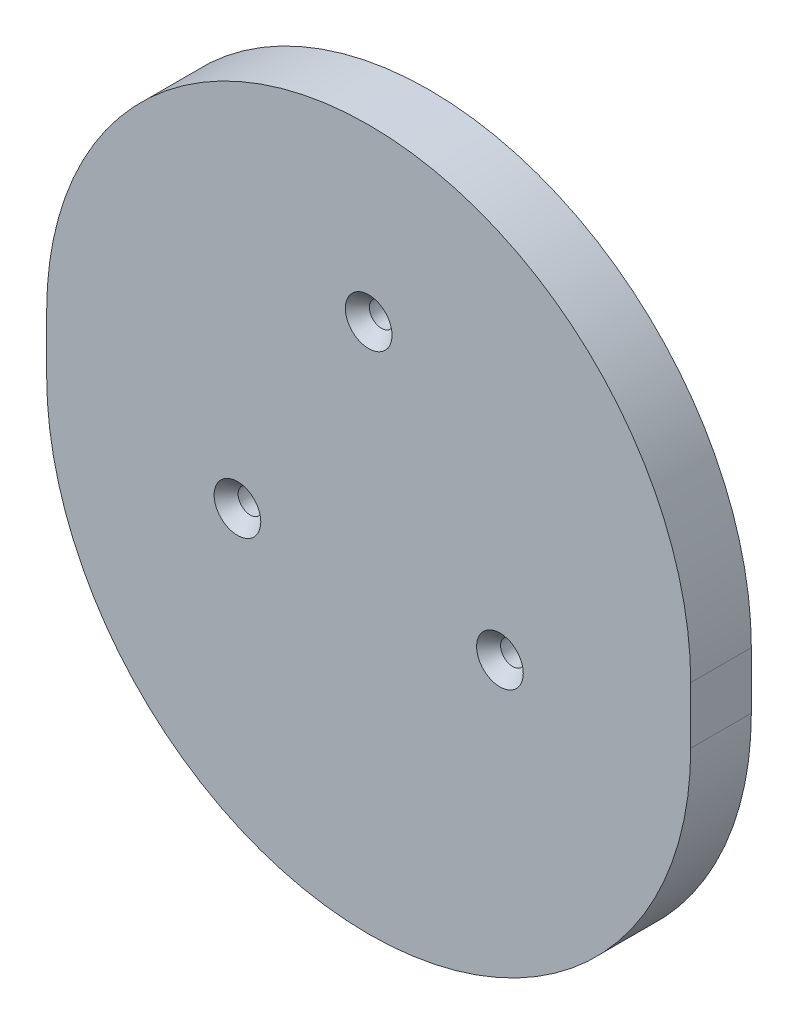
SolidWorks part; units mm, degrees
ref_plane "Front Plane" through (0, 0, 0) normal (0, 0, 1) x (1, 0, 0)
ref_plane "Top Plane" through (0, 0, 0) normal (0, 1, 0) x (1, 0, 0)
ref_plane "Right Plane" through (0, 0, 0) normal (1, 0, 0) x (0, 0, -1)
sketch "Sketch2" plane through (0, 0, 0) normal (0, 0, 1) x (1, 0, 0)
  line L0 (0, 0) -> (0, 82.931) construction
  line L2 (-82.423, 34.1376) -> (-99.0577, 34.1376)
  line L4 (91.948, -48.7934) -> (91.948, 34.1376) construction
  line L5 (99.0577, 34.1376) -> (82.423, 34.1376)
  line L6 (-91.948, -48.7934) -> (-91.948, 34.1376) construction
  line L7 (82.423, -14.3002) -> (82.423, -48.4124)
  line L9 (82.423, 34.1376) -> (82.423, 14.2748)
  line L10 (82.423, -48.4124) -> (92.9195, -48.4124)
  line L11 (-82.423, -48.4124) -> (-92.9195, -48.4124)
  line L12 (-82.423, 34.1376) -> (-82.423, -48.4124)
  arc A0 (99.0577, 34.1376) -> (-99.0577, 34.1376) centre (0, 0) ccw
  arc A1 (82.423, 14.2748) -> (82.423, -14.3002) centre (82.423, -0.0127) ccw
  arc A2 (-92.9195, -48.4124) -> (92.9195, -48.4124) centre (0, 0) ccw
  circle A3 centre (0, 0) radius 132.5563 construction
  dimension "D4" = 209.55
  dimension "D7" = 28.575
  dimension "D14" = 265.1125
  dimension "D2" = 164.846
  dimension "D3" = 19.8628
  dimension "D5" = 34.1376
  dimension "D6" = 183.896
  dimension "D8" = 48.4124
  dimension "D9" = 82.423
  dimension "D10" = 82.423
  dimension "D11" = 91.948
  dimension "D12" = 91.948
  dimension "D13" = 82.55
extrude "Boss-Extrude1" add sketch "Sketch2" against normal blind 12.7
hole_wizard "#10-32 Tapped Hole1" positions "Sketch11" profile "Sketch10" tap size "#10-32" standard "Ansi Inch"
sketch "Sketch11" plane through (82.423, 0, 0) normal (1, 0, 0) x (0, 0, -1)
  line L0 (12.7, 34.1376) -> (0, 34.1376) construction
  line L2 (12.7, 34.1376) -> (12.7, -48.4124) construction
  line L3 (12.7, -48.4124) -> (0, -48.4124) construction
  point P0 (6.35, 24.6126)
  point P4 (6.35, -38.8874)
  dimension "D1" = 6.35
  dimension "D2" = 9.525
  dimension "D3" = 24.6126
  dimension "D4" = 63.5
  dimension "D5" = 38.8874
  dimension "D6" = 9.525
sketch "Sketch10" plane through (82.423, 24.6126, -6.35) normal (0, 1, 0) x (0, 0, -1)
  line L0 (0, 0) -> (0, 13.2529)
  line L1 (0, 13.2529) -> (2.0193, 12.0396)
  line L2 (2.0193, 12.0396) -> (2.0193, 0)
  line L5 (2.0193, 0) -> (0, 0)
  line L10 (0, 13.2529) -> (-2.0193, 12.0396) construction
  line L11 (0, -6.35) -> (0, 107.95) construction
  dimension "Tap Drill Dia." = 4.0386
  dimension "Tap Drill Depth" = 12.0396
  dimension "Drill Angle" = 118
hole_wizard "#10-32 Tapped Hole2" positions "Sketch13" profile "Sketch12" tap size "#10-32" standard "Ansi Inch"
sketch "Sketch13" plane through (-82.423, 0, 0) normal (-1, 0, 0) x (0, 0, 1)
  line L1 (-12.7, 34.1376) -> (0, 34.1376) construction
  line L3 (-12.7, 34.1376) -> (-12.7, -48.4124) construction
  point P0 (-6.35, -38.8874)
  point P4 (-6.35, 24.6126)
  dimension "D1" = 6.35
  dimension "D2" = 63.5
  dimension "D3" = 9.525
  dimension "D4" = 24.6126
  dimension "D5" = 38.8874
sketch "Sketch12" plane through (-82.423, -38.8874, -6.35) normal (0, 1, 0) x (0, 0, 1)
  line L0 (0, 0) -> (0, 13.2529)
  line L1 (0, 13.2529) -> (2.0193, 12.0396)
  line L2 (2.0193, 12.0396) -> (2.0193, 0)
  line L5 (2.0193, 0) -> (0, 0)
  line L10 (0, 13.2529) -> (-2.0193, 12.0396) construction
  line L11 (0, -6.35) -> (0, 107.95) construction
  dimension "Tap Drill Dia." = 4.0386
  dimension "Tap Drill Depth" = 12.0396
  dimension "Drill Angle" = 118
hole_wizard "CSK for #10 Flat Head Machine Screw1" positions "Sketch9" profile "Sketch8" countersink size "#10" standard "ANSI Inch"
sketch "Sketch9" plane through (82.423, 26.8097, 0) normal (0, 0, 1) x (1, 0, 0)
  line L3 (-82.423, -26.8097) -> (-82.423, 4.9403) construction
  line L4 (-82.423, -26.8097) -> (-54.9267, -42.6847) construction
  line L5 (-82.423, -26.8097) -> (-109.9193, -42.6847) construction
  circle A1 centre (-82.423, -26.8097) radius 31.75 construction
  point P9 (-82.423, 4.9403)
  point P11 (-54.9267, -42.6847)
  point P46 (-109.9193, -42.6847)
  dimension "D1" = 31.75
  dimension "D3" = 120
  dimension "D2" = 120
sketch "Sketch8" plane through (0, 31.75, 0) normal (1, 0, 0) x (0, -1, 0)
  line L0 (0, 0) -> (0, 12.7)
  line L1 (0, 12.7) -> (2.5527, 12.7)
  line L2 (2.5527, 12.7) -> (2.5527, 2.6882)
  line L3 (2.5527, 2.6882) -> (4.8895, 0)
  line L5 (4.8895, 0) -> (0, 0)
  line L6 (-2.5527, 2.6882) -> (-4.8895, 0) construction
  line L11 (0, -6.35) -> (0, 107.95) construction
  dimension "Thru Hole Dia." = 5.1054
  dimension "Thru Hole Depth" = 12.7
  dimension "Near C'Sink Dia." = 9.779
  dimension "Near C'Sink Angle" = 82
sketch "Sketch19" plane through (0, 0, 0) normal (1, 0, 0) x (0, 0, -1)
  line L0 (12.7, 104.775) -> (0, 104.775) construction
  line L1 (3.175, 104.775) -> (12.7, 104.775)
  line L2 (3.175, 104.775) -> (3.175, 84.1375)
  line L3 (3.175, 84.1375) -> (12.7, 84.1375)
  line L4 (12.7, 104.775) -> (12.7, 84.1375)
  line L5 (12.7, 34.1376) -> (12.7, 104.775) construction
  dimension "D1" = 9.525
  dimension "D2" = 20.6375
  dimension "D3" = 84.1375
extrude "PAR Cut-Extrude5" cut sketch "Sketch19" against normal through all and the other way through all
sketch "Sketch18" plane through (0, 0, 0) normal (0, 0, 1) x (1, 0, 0)
  line L0 (67.4688, 0) -> (67.4687, -11.9063)
  line L1 (-67.4688, 0) -> (-67.4687, -11.9063)
  arc A0 (67.4688, 0) -> (-67.4688, 0) centre (0, 0) ccw
  arc A1 (67.4687, -11.9063) -> (-67.4687, -11.9063) centre (0, -11.9063) cw
  dimension "D1" = 134.9375
  dimension "D2" = 67.4688
  dimension "D3" = 79.375
extrude "Cut-Extrude4" cut sketch "Sketch18" against normal through all flip side to cut
equation "\"Buoyancy\"= \"SW-Volume\" * ( \"SW-Density\" - .037062 )"
